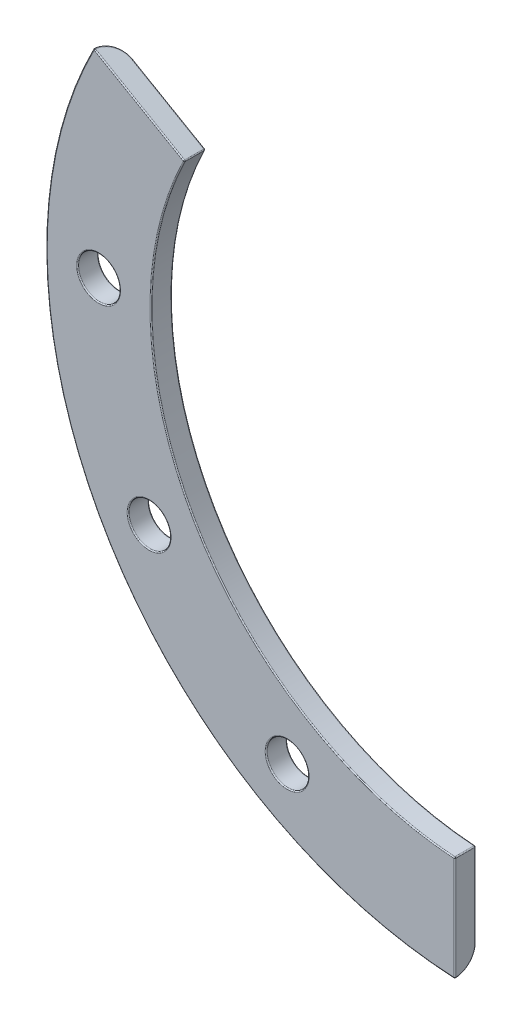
SolidWorks part; units mm, degrees
ref_plane "Спереди" through (0, 0, 0) normal (0, 0, 1) x (1, 0, 0)
ref_plane "Сверху" through (0, 0, 0) normal (0, 1, 0) x (1, 0, 0)
ref_plane "Справа" through (0, 0, 0) normal (1, 0, 0) x (0, 0, -1)
sketch "Эскиз1" plane through (0, 0, 0) normal (0, 0, 1) x (1, 0, 0)
  line L0 (0, 0) -> (0, -205) construction
  line L1 (0, 0) -> (-177.5352, 102.5) construction
  line L2 (-182.3239, 93.7177) -> (-138.9543, 68.6783)
  line L3 (-10, -154.6771) -> (-10, -204.756)
  line L4 (0, 0) -> (-205, 0) construction
  line L5 (-177.5352, -102.5) -> (0, 0) construction
  line L6 (0, 0) -> (-102.5, -177.5352) construction
  arc A0 (-182.3239, 93.7177) -> (-10, -204.756) centre (0, 0) ccw
  arc A1 (-160.6438, 81.2007) -> (-10, -179.722) centre (0, 0) ccw construction
  arc A2 (-138.9543, 68.6783) -> (-10, -154.6771) centre (0, 0) ccw
  circle A3 centre (0, 0) radius 205 construction
  circle A4 centre (0, 0) radius 180 construction
  circle A5 centre (0, 0) radius 155 construction
  circle A6 centre (-180, 0) radius 10
  circle A7 centre (-90, -155.8846) radius 10
  circle A8 centre (-155.8846, -90) radius 10
  dimension "D1" = 410
  dimension "D9" = 20
  dimension "D4" = 120
  dimension "D5" = 10
  dimension "D6" = 10
  dimension "D7" = 30
  dimension "D8" = 30
  dimension "D2" = 25
  dimension "D3" = 50
extrude "Бобышка-Вытянуть1" add sketch "Эскиз1" along normal mid plane 10
fillet "Скругление1" radius 10 1 edges at (-177.5352, -102.5, -5)
fillet "Скругление2" radius 0.5 17 edges at (-10, -154.6771, 0) (-10, -174.7103, -5) (-10, -202.5666, -1.2413) (-10, -179.7165, 5) (-138.9543, 68.6783, 0) (-160.6391, 81.198, 5) (-179.0748, 91.8419, -2.8039) (-156.3035, 78.6949, -5) (-80, -155.8846, -5) (-80, -155.8846, 5) (-145.8846, -90, -5) (-145.8846, -90, 5) (-170, 0, -5) (-170, 0, 5) (-177.5352, -102.5, 5) (-134.2339, -77.5, -5) (-134.2339, -77.5, 5)
